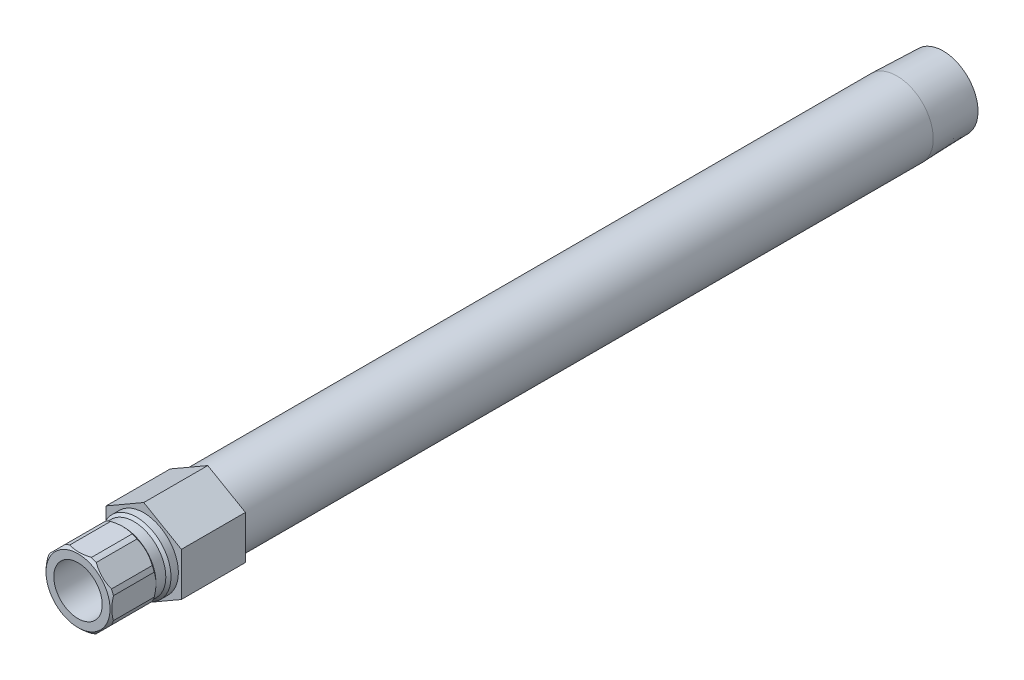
SolidWorks part; units mm, degrees
ref_plane "Front Plane" through (0, 0, 0) normal (0, 0, 1) x (1, 0, 0)
ref_plane "Top Plane" through (0, 0, 0) normal (0, 1, 0) x (1, 0, 0)
ref_plane "Right Plane" through (0, 0, 0) normal (1, 0, 0) x (0, 0, -1)
sketch "Sketch1" plane through (0, 0, 0) normal (1, 0, 0) x (0, 0, -1)
  line L0 (0, 0) -> (-22.479, 0) construction
  line L1 (-19.304, 7.112) -> (-19.304, 9.398)
  line L2 (-5.8166, 9.398) -> (-5.8166, 0) construction
  line L3 (-18.542, 10.16) -> (-6.5786, 10.16)
  line L4 (0, 10.668) -> (0, 0) construction
  line L5 (-5.8166, 9.398) -> (-2.921, 9.398)
  line L6 (-2.159, 10.16) -> (0, 10.16)
  line L7 (0, 10.16) -> (0, 10.668)
  line L8 (-5.8166, 9.398) -> (-6.5786, 10.16)
  line L9 (-2.921, 9.398) -> (-2.159, 10.16)
  line L10 (-19.304, 9.398) -> (-18.542, 10.16)
  line L11 (-19.304, 7.112) -> (-1.524, 7.112)
  line L12 (0, 10.668) -> (221.1324, 10.668)
  line L13 (221.1324, 10.668) -> (234.696, 10.2441)
  line L14 (234.696, 10.2441) -> (234.696, 7.8994)
  line L15 (0, 10.16) -> (18.796, 10.16) construction
  line L16 (18.796, 10.16) -> (18.796, 0) construction
  line L17 (18.796, 0) -> (0, 0) construction
  line L18 (-1.524, 7.112) -> (-1.1053, 7.8994)
  line L19 (-1.1053, 7.8994) -> (234.696, 7.8994)
  dimension "D1" = 19.304
  dimension "D2" = 2.8956
  dimension "D3" = 0.762
  dimension "D4" = 45
  dimension "D5" = 13.4874
  dimension "D6" = 45
  dimension "D7" = 1.79
  dimension "D8" = 13.5636
  dimension "D9" = 254
  dimension "D10" = 3.175
  dimension "D11" = 38.1
  dimension "D12" = 14.224
  dimension "D13" = 21.336
  dimension "D14" = 20.32
  dimension "D15" = 15.7988
  dimension "D16" = 118
  dimension "D17" = 17.78
revolve "Revolve1" add sketch "Sketch1" angle 360 about L0
sketch "Sketch2" plane through (0, 0, 0) normal (0, 0, 1) x (1, 0, 0)
  line L1 (-11.049, 6.3791) -> (-11.049, -6.3791)
  line L2 (-11.049, -6.3791) -> (0, -12.7583)
  line L3 (0, -12.7583) -> (11.049, -6.3791)
  line L4 (11.049, -6.3791) -> (11.049, 6.3791)
  line L5 (11.049, 6.3791) -> (0, 12.7583)
  line L6 (0, 12.7583) -> (-11.049, 6.3791)
  circle A0 centre (0, 0) radius 11.049 construction
  circle A1 centre (0, 0) radius 7.112 construction
  circle A2 centre (0, 0) radius 7.112
  dimension "D1" = 22.098
extrude "Boss-Extrude1" add sketch "Sketch2" against normal up to vertex (18.796 mm away) from vertex at 0
sketch "Sketch3" plane through (0, 0, 0) normal (0, 0, 1) x (1, 0, 0)
  line L1 (9.652, -3.998) -> (9.652, 3.998)
  line L2 (9.652, 3.998) -> (3.998, 9.652)
  line L3 (3.998, 9.652) -> (-3.998, 9.652)
  line L4 (-3.998, 9.652) -> (-9.652, 3.998)
  line L5 (-9.652, 3.998) -> (-9.652, -3.998)
  line L6 (-9.652, -3.998) -> (-3.998, -9.652)
  line L7 (-3.998, -9.652) -> (3.998, -9.652)
  line L8 (3.998, -9.652) -> (9.652, -3.998)
  circle A0 centre (0, 0) radius 9.652 construction
  dimension "D1" = 19.304
extrude "Cut-Extrude1" cut sketch "Sketch3" along normal through all from vertex at 5.8166 flip side to cut
